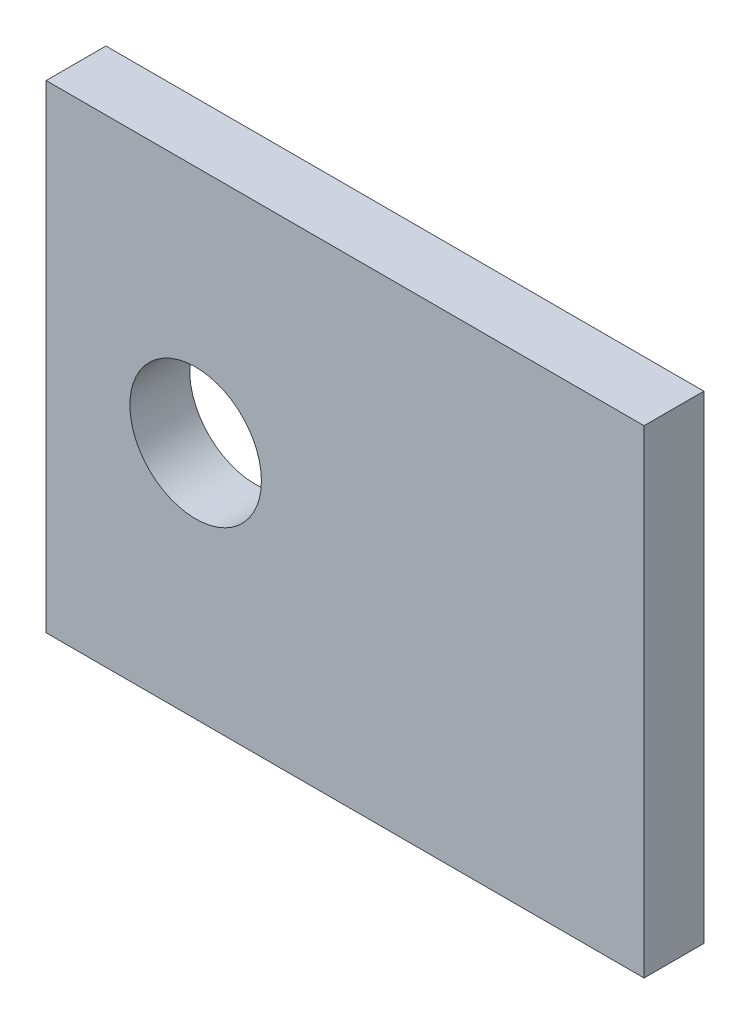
SolidWorks part; units mm, degrees
ref_plane "Plan de face" through (0, 0, 0) normal (0, 0, 1) x (1, 0, 0)
ref_plane "Plan de dessus" through (0, 0, 0) normal (0, 1, 0) x (1, 0, 0)
ref_plane "Plan de droite" through (0, 0, 0) normal (1, 0, 0) x (0, 0, -1)
sketch "Esquisse1" plane through (0, 0, 0) normal (0, 0, 1) x (1, 0, 0)
  line L1 (0, 0) -> (100, 0)
  line L2 (0, 0) -> (0, 80)
  line L3 (0, 80) -> (100, 80)
  line L4 (100, 0) -> (100, 80)
  dimension "D1" = 80
  dimension "D2" = 100
extrude "Extrusion1" add sketch "Esquisse1" along normal blind 10
hole_wizard "Dégagement M201" positions "Esquisse3D1" profile "Esquisse3" hole size "M20" standard "ISO"
sketch3d "Esquisse3D1"
  line L0 (100, 80, 10) -> (0, 80, 10) construction
  line L2 (0, 80, 10) -> (0, 0, 10) construction
  point P0 (25, 40, 10)
  dimension "D1" = 40
  dimension "D2" = 25
sketch "Esquisse3" plane through (25, 40, 10) normal (1, 0, 0) x (0, -1, 0)
  line L0 (0, 0) -> (0, 10)
  line L1 (0, 10) -> (11, 10)
  line L2 (11, 10) -> (11, 0)
  line L5 (11, 0) -> (0, 0)
  line L11 (0, -6.35) -> (0, 107.95) construction
  dimension "Diamètre du perçage jusqu'au prochain" = 22
  dimension "Profondeur du perçage jusqu'au prochain" = 10
